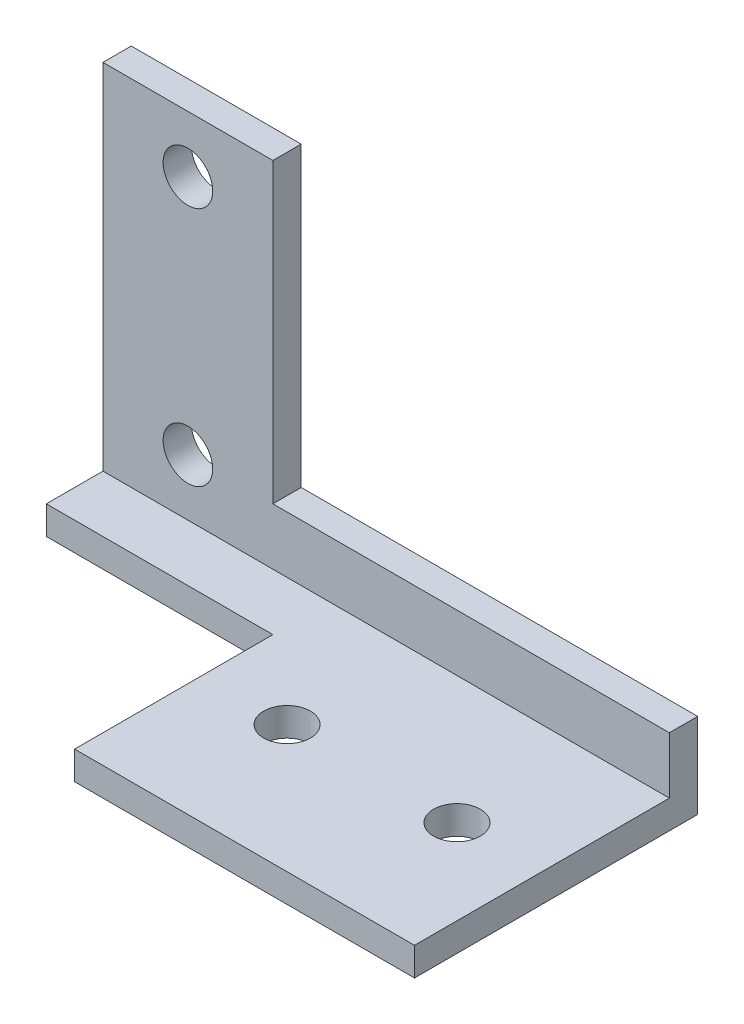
SolidWorks part; units mm, degrees
ref_plane "Front Plane" through (0, 0, 0) normal (0, 0, 1) x (1, 0, 0)
ref_plane "Top Plane" through (0, 0, 0) normal (0, 1, 0) x (1, 0, 0)
ref_plane "Right Plane" through (0, 0, 0) normal (1, 0, 0) x (0, 0, -1)
sketch "Sketch1" plane through (0, 0, 0) normal (1, 0, 0) x (0, 0, -1)
  line L0 (0, 27) -> (0, 0)
  line L1 (0, 0) -> (-20, 0)
  line L2 (-20, 0) -> (-20, 2)
  line L3 (-20, 2) -> (-2, 2)
  line L4 (-2, 2) -> (-2, 27)
  line L5 (-2, 27) -> (0, 27)
  dimension "D1" = 2
  dimension "D2" = 2
  dimension "D3" = 27
  dimension "D4" = 20
extrude "Extrude1" add sketch "Sketch1" along normal blind 40
sketch "Sketch2" plane through (0, 0, 2) normal (0, 0, 1) x (1, 0, 0)
  line L1 (40, 27) -> (12, 27)
  line L2 (40, 27) -> (40, 6)
  line L3 (40, 6) -> (12, 6)
  line L4 (12, 27) -> (12, 6)
  dimension "D1" = 28
  dimension "D2" = 21
extrude "Extrude2" cut sketch "Sketch2" against normal blind 40
sketch "Sketch3" plane through (0, 2, 0) normal (0, 1, 0) x (1, 0, 0)
  line L0 (12, 0) -> (0, 0) construction
  line L1 (0, -20) -> (16, -20)
  line L2 (0, -20) -> (0, -6)
  line L3 (0, -6) -> (16, -6)
  line L4 (16, -20) -> (16, -6)
  dimension "D1" = 16
  dimension "D2" = 6
extrude "Extrude3" cut sketch "Sketch3" against normal blind 40
sketch "Sketch4" plane through (0, 0, 2) normal (0, 0, 1) x (1, 0, 0)
  line L0 (6, 27) -> (6, 2) construction
  line L1 (12, 27) -> (0, 27) construction
  line L2 (40, 2) -> (0, 2) construction
  circle A0 centre (6, 23) radius 1.75
  circle A1 centre (6, 6) radius 1.75
  dimension "D1" = 4
  dimension "D2" = 17
  dimension "D3" = 3.5
extrude "Extrude4" cut sketch "Sketch4" against normal blind 40
sketch "Sketch5" plane through (0, 2, 0) normal (0, 1, 0) x (1, 0, 0)
  line L0 (40, -11) -> (16, -11) construction
  line L1 (40, -2) -> (40, -20) construction
  line L2 (16, -20) -> (16, -6) construction
  line L3 (40, -20) -> (16, -20) construction
  point P6 (34, -11)
  point P7 (22, -11)
  dimension "D1" = 9
  dimension "D2" = 6
  dimension "D3" = 12
hole_wizard "M4 Tapped Hole1" positions "3DSketch1" profile "Sketch6" tap size "M4" standard "ISO"
sketch3d "3DSketch1"
  point P0 (34, 2, 11)
  point P3 (22, 2, 11)
sketch "Sketch6" plane through (34, 2, 11) normal (1, 0, 0) x (0, 0, 1)
  line L0 (0, 0) -> (0, 2)
  line L1 (0, 2) -> (1.65, 2)
  line L2 (1.65, 2) -> (1.65, 0)
  line L5 (1.65, 0) -> (0, 0)
  line L11 (0, -6.35) -> (0, 107.95) construction
  dimension "Thru Tap Drill Dia." = 3.3
  dimension "Thru Tap Drill Depth" = 2
